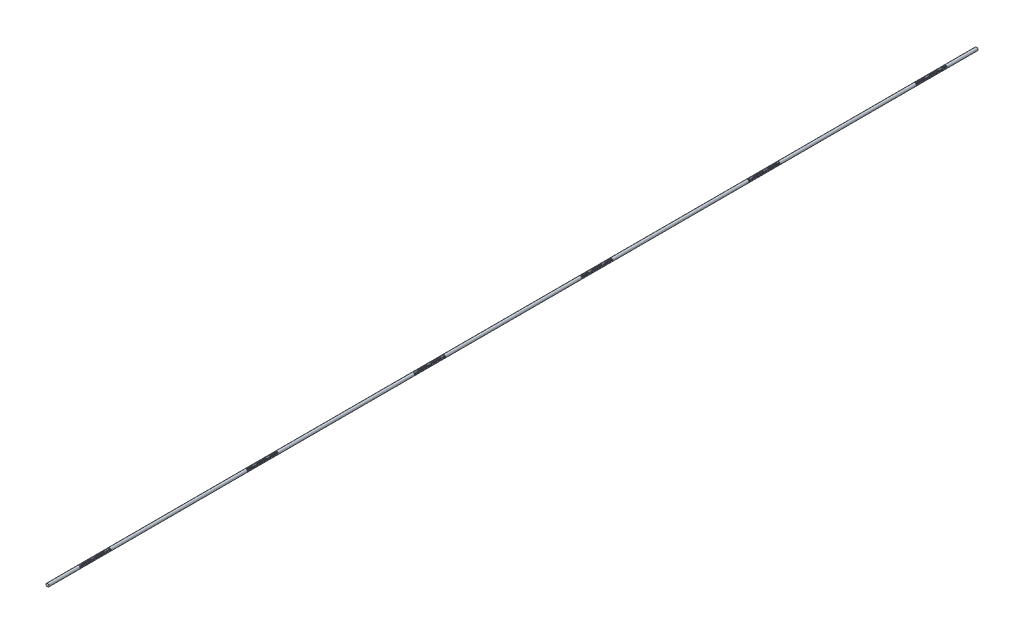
SolidWorks part; units mm, degrees
ref_plane "Front Plane" through (0, 0, 0) normal (0, 0, 1) x (1, 0, 0)
ref_plane "Top Plane" through (0, 0, 0) normal (0, 1, 0) x (1, 0, 0)
ref_plane "Right Plane" through (0, 0, 0) normal (1, 0, 0) x (0, 0, -1)
sketch "Sketch1" plane through (0, 0, 0) normal (0, 0, 1) x (1, 0, 0)
  circle A0 centre (0, 0) radius 5
  dimension "D1" = 10
extrude "Boss-Extrude1" add sketch "Sketch1" along normal mid plane 3000
chamfer "Chamfer1" distance 0.25 angle 45 2 edges at (5, 0, -1500) (5, 0, 1500)
sketch "Sketch2" plane through (0, 0, 0) normal (1, 0, 0) x (0, 0, -1)
  line L0 (1400.1675, 5) -> (1398.8325, 5)
  line L1 (1499.75, 5) -> (-1499.75, 5) construction
  line L2 (1398.8325, 5) -> (1399.1675, 3.75)
  line L3 (1399.1675, 3.75) -> (1399.8325, 3.75)
  line L4 (1399.8325, 3.75) -> (1400.1675, 5)
  line L5 (1500, -4.75) -> (1500, 4.75) construction
  point P4 (1399.5, 5)
  point P7 (1399.5, 3.75)
  point P8 (1400, 4.375)
  point P9 (1399, 4.375)
  dimension "D1" = 1
  dimension "D2" = 100
  dimension "D3" = 1.25
  dimension "D4" = 30
revolve "Cut-Revolve1" cut sketch "Sketch2" angle 360 about axis through (0, 0, 1500) along (0, 0, -1)
pattern_linear "LPattern1" count 50 spacing 2 along (0, 0, 1) of "Cut-Revolve1"
pattern_linear "LPattern2" count 6 spacing 540 along (0, 0, 1) of "Cut-Revolve1", "LPattern1"
